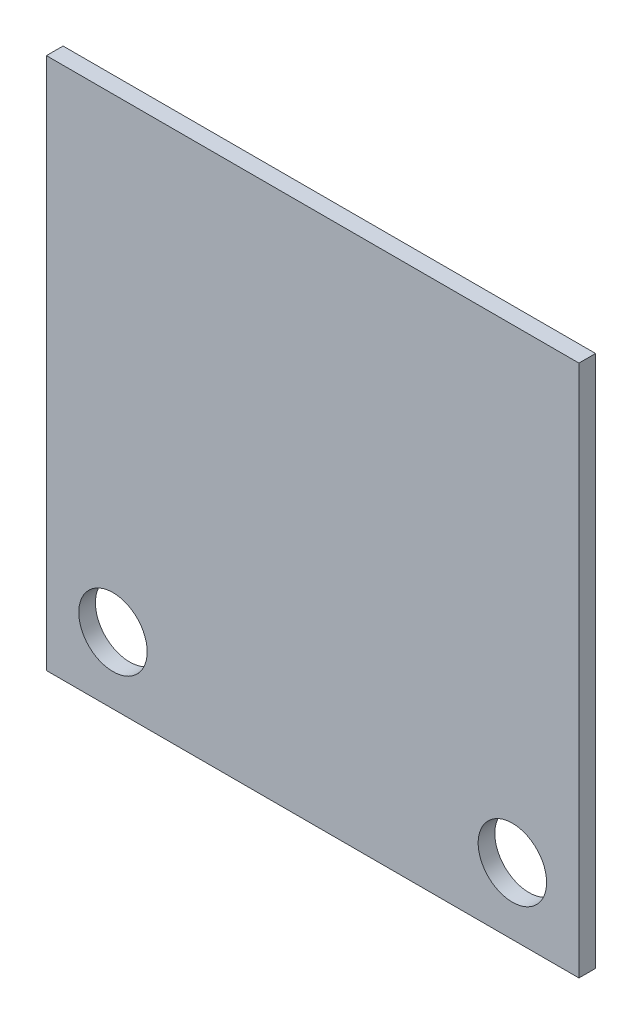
SolidWorks part; units mm, degrees
ref_plane "Front" through (0, 0, 0) normal (0, 0, 1) x (1, 0, 0)
ref_plane "Top" through (0, 0, 0) normal (0, 1, 0) x (1, 0, 0)
ref_plane "Right" through (0, 0, 0) normal (1, 0, 0) x (0, 0, -1)
sketch "Sketch1" plane through (0, 0, 0) normal (0, 0, 1) x (1, 0, 0)
  line L1 (-12.7, 25.4) -> (12.7, 25.4)
  line L2 (-12.7, 25.4) -> (-12.7, 0)
  line L3 (-12.7, 0) -> (12.7, 0)
  line L4 (12.7, 25.4) -> (12.7, 0)
  point P4 (0, 0)
  dimension "D1" = 25.4
  dimension "D2" = 25.4
extrude "Extrude1" add sketch "Sketch1" along normal blind 0.7937
hole_wizard "#30 (0.128500) Diameter Hole1" positions "3DSketch1" profile "Sketch2" hole size "#30" standard "Ansi Inch"
sketch3d "3DSketch1"
  line L0 (-12.7, 0, 0) -> (12.7, 0, 0) construction
  line L2 (-12.7, 25.4, 0.7937) -> (-12.7, 0, 0.7937) construction
  point P0 (-9.525, 3.175, 0.7937)
  point P1 (9.525, 3.175, 0.7937)
  dimension "D1" = 19.05
  dimension "D2" = 3.2727
  dimension "D3" = 3.175
sketch "Sketch2" plane through (-9.525, 3.175, 0.7937) normal (1, 0, 0) x (0, -1, 0)
  line L0 (0, 0) -> (0, 0.7938)
  line L1 (0, 0.7938) -> (1.6319, 0.7938)
  line L2 (1.6319, 0.7938) -> (1.6319, 0)
  line L5 (1.6319, 0) -> (0, 0)
  line L11 (0, -6.35) -> (0, 107.95) construction
  dimension "Thru Hole Dia." = 3.2639
  dimension "Thru Hole Depth" = 0.7937
chamfer "Chamfer1" [suppressed] distance 7.112 angle 45
